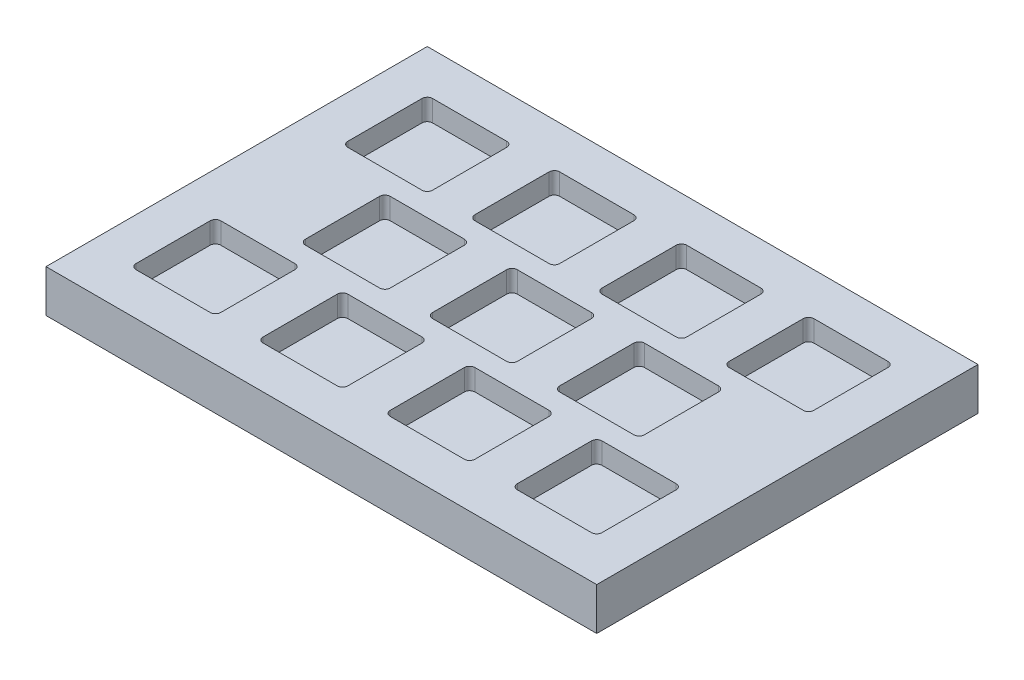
SolidWorks part; units mm, degrees
ref_plane "Front Plane" through (0, 0, 0) normal (0, 0, 1) x (1, 0, 0)
ref_plane "Top Plane" through (0, 0, 0) normal (0, 1, 0) x (1, 0, 0)
ref_plane "Right Plane" through (0, 0, 0) normal (1, 0, 0) x (0, 0, -1)
sketch "Sketch1" plane through (0, 0, 0) normal (0, 1, 0) x (1, 0, 0)
  line L0 (-82.55, -57.15) -> (82.55, 57.15) construction
  line L1 (-82.55, 57.15) -> (82.55, 57.15)
  line L2 (-82.55, 57.15) -> (-82.55, -57.15)
  line L3 (-82.55, -57.15) -> (82.55, -57.15)
  line L4 (82.55, 57.15) -> (82.55, -57.15)
  dimension "D1" = 165.1
  dimension "D2" = 114.3
extrude "Extrude1" add sketch "Sketch1" along normal blind 12.7
sketch "Sketch2" plane through (0, 12.7, 0) normal (0, 1, 0) x (-1, 0, 0)
  line L0 (-82.55, -57.15) -> (82.55, -57.15) construction
  line L1 (44.45, -44.45) -> (69.85, -44.45)
  line L2 (44.45, -44.45) -> (44.45, -19.05)
  line L3 (44.45, -19.05) -> (69.85, -19.05)
  line L4 (69.85, -44.45) -> (69.85, -19.05)
  line L5 (82.55, -57.15) -> (82.55, 57.15) construction
  dimension "D1" = 25.4
  dimension "D2" = 25.4
  dimension "D3" = 12.7
  dimension "D4" = 12.7
extrude "Cut-Extrude1" cut sketch "Sketch2" against normal blind 6.35
sketch "Sketch3" plane through (0, 12.7, 0) normal (0, 1, 0) x (-1, 0, 0)
  line L0 (69.85, -19.05) -> (44.45, -19.05) construction
  line L1 (25.4, -12.7) -> (50.8, -12.7)
  line L2 (25.4, -12.7) -> (25.4, 12.7)
  line L3 (25.4, 12.7) -> (50.8, 12.7)
  line L4 (50.8, -12.7) -> (50.8, 12.7)
  line L5 (82.55, -57.15) -> (82.55, 57.15) construction
  dimension "D1" = 25.4
  dimension "D2" = 25.4
  dimension "D3" = 6.35
  dimension "D4" = 31.75
extrude "Cut-Extrude2" cut sketch "Sketch3" against normal blind 6.35
fillet "Fillet1" radius 1.5875 4 edges at (-44.45, 9.525, -44.45) (-44.45, 9.525, -19.05) (-69.85, 9.525, -19.05) (-69.85, 9.525, -44.45)
pattern_linear "LPattern1" count 4 spacing 38.1 along (1, 0, 0) count 2 spacing 63.5 along (0, 0, 1) of "Cut-Extrude1", "Fillet1"
fillet "Fillet2" radius 1.5875 4 edges at (-25.4, 9.525, -12.7) (-25.4, 9.525, 12.7) (-50.8, 9.525, 12.7) (-50.8, 9.525, -12.7)
pattern_linear "LPattern2" count 3 spacing 38.1 along (1, 0, 0) of "Fillet2", "Cut-Extrude2"
